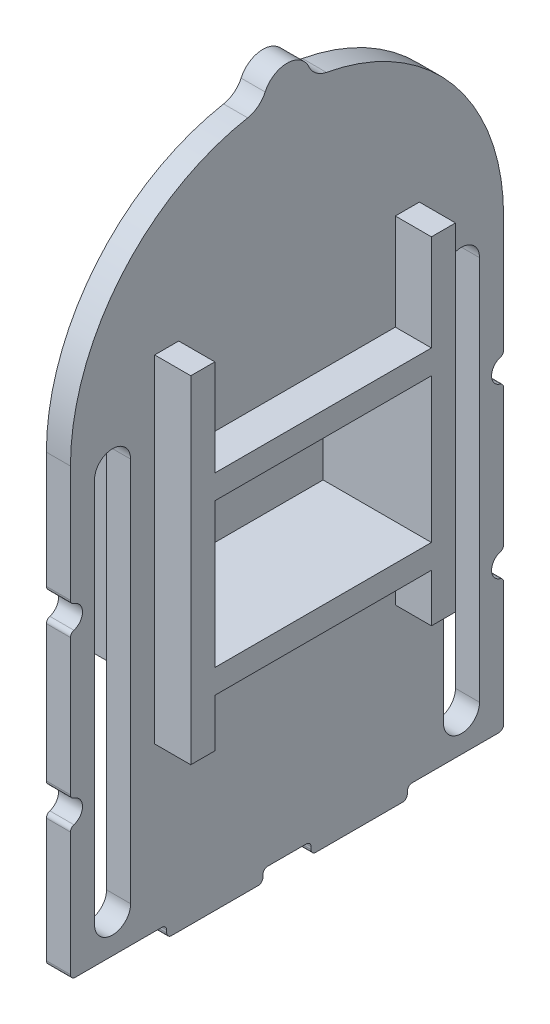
SolidWorks part; units mm, degrees
ref_plane "Face" through (0, 0, 0) normal (0, 0, 1) x (1, 0, 0)
ref_plane "Dessus" through (0, 0, 0) normal (0, 1, 0) x (1, 0, 0)
ref_plane "Droite" through (0, 0, 0) normal (1, 0, 0) x (0, 0, -1)
sketch "Esquisse1" plane through (0, 0, 0) normal (1, 0, 0) x (0, 0, -1)
  line L0 (9, 0) -> (9, -5)
  line L1 (-9, 0) -> (-9, -5)
  line L2 (9, -18.5) -> (5, -18.5)
  line L3 (-5, -19) -> (-1, -19)
  line L4 (5, -18.5) -> (5, -19)
  line L5 (1, -19) -> (1, -18.5)
  line L6 (1, -18.5) -> (-1, -18.5)
  line L7 (-1, -18.5) -> (-1, -19)
  line L8 (-5, -19) -> (-5, -18.5)
  line L9 (-5, -18.5) -> (-9, -18.5)
  line L10 (-13.0095, -12.5) -> (10.4273, -12.5) construction
  line L11 (10.4273, -5.5) -> (-12.6677, -5.5) construction
  line L12 (1, -19) -> (5, -19)
  line L13 (0, 0) -> (0, -17.0505) construction
  line L14 (9, -6) -> (9, -12)
  line L15 (6.5, -1) -> (6.5, -17)
  line L16 (9, -13) -> (9, -18.5)
  line L17 (-8, -1) -> (-8, -17)
  line L18 (-9, -6) -> (-9, -12)
  line L19 (8, -1) -> (8, -17)
  line L20 (-9, -13) -> (-9, -18.5)
  line L21 (-6.5, -1) -> (-6.5, -17)
  arc A0 (9, 0) -> (1.6363, 8.85) centre (0, 0) ccw
  arc A1 (9, -5) -> (9, -6) centre (9, -5.5) ccw
  arc A2 (9, -12) -> (9, -13) centre (9, -12.5) ccw
  arc A3 (-9, -6) -> (-9, -5) centre (-9, -5.5) ccw
  arc A4 (-9, -13) -> (-9, -12) centre (-9, -12.5) ccw
  arc A5 (-6.5, -1) -> (-8, -1) centre (-7.25, -1) ccw
  arc A6 (-8, -17) -> (-6.5, -17) centre (-7.25, -17) ccw
  arc A7 (8, -17) -> (6.5, -17) centre (7.25, -17) cw
  arc A8 (6.5, -1) -> (8, -1) centre (7.25, -1) cw
  arc A9 (0.9091, 9.4167) -> (-0.9091, 9.4167) centre (0, 9) ccw
  arc A10 (-0.9091, 9.4167) -> (-1.6363, 8.85) centre (-1.8181, 9.8333) cw
  arc A11 (-1.6363, 8.85) -> (-9, 0) centre (0, 0) ccw
  arc A12 (0.9091, 9.4167) -> (1.6363, 8.85) centre (1.8181, 9.8333) ccw
  point P46 (0, 0)
  point P48 (-0.5183, 8.9851)
  point P50 (-0.9985, 8.9444)
  dimension "D3" = 18.5
  dimension "D4" = 4
  dimension "D8" = 4
  dimension "D9" = 0.5
  dimension "D10" = 0.5
  dimension "D11" = 0.5
  dimension "D12" = 0.5
  dimension "D21" = 1
  dimension "D22" = 1
  dimension "D1" = 19
  dimension "D2" = 9
  dimension "D5" = 4
  dimension "D6" = 2
  dimension "D7" = 1
  dimension "D13" = 13
  dimension "D14" = 7
  dimension "D15" = 9
  dimension "D16" = 9
  dimension "D17" = 1.5
  dimension "D18" = 1
  dimension "D19" = 16
  dimension "D20" = 1
extrude "Extrusion1" add sketch "Esquisse1" along normal blind 1
sketch "Esquisse2" plane through (0, 0, 0) normal (-1, 0, 0) x (0, 0, 1)
  line L1 (-5.5, -9.75) -> (5.5, -9.75)
  line L2 (-5.5, -9.75) -> (-5.5, -1.75)
  line L3 (-5.5, -1.75) -> (5.5, -1.75)
  line L4 (5.5, -9.75) -> (5.5, -1.75)
  arc A0 (8, -1) -> (6.5, -1) centre (7.25, -1) ccw construction
  dimension "D1" = 8
  dimension "D3" = 11
  dimension "D4" = 5.5
extrude "Extrusion2" add sketch "Esquisse2" along normal blind 3
fillet "Congé1" radius 1 4 edges at (-3, -9.75, 0) (-3, -5.75, 5.5) (-3, -1.75, 0) (-3, -5.75, -5.5)
sketch "Esquisse3" plane through (0, 0, 0) normal (0, 0, 1) x (1, 0, 0)
  line L0 (-3, -2.75) -> (-3, -8.75) construction
  line L1 (-3, -5.25) -> (-3, -6.25)
  line L2 (-3, -3.05) -> (-3, -4.05)
  line L3 (-3, -7.45) -> (-3, -8.45)
  arc A0 (-3, -5.25) -> (-3, -6.25) centre (-3, -5.75) ccw
  arc A1 (-3, -3.05) -> (-3, -4.05) centre (-3, -3.55) ccw
  arc A2 (-3, -7.45) -> (-3, -8.45) centre (-3, -7.95) ccw
  dimension "D1" = 0.5
  dimension "D2" = 2.2
  dimension "D3" = 2.2
extrude "Extrusion4" add sketch "Esquisse3" along normal blind 4 and the other way blind 4
fillet "Congé2" radius 0.2 18 edges at (0.5, -18.5, 1) (0.5, -13, 9) (0.5, -6, 9) (0.5, -18.5, 5) (0.5, -18.5, -1) (0.5, -12, 9) (0.5, -5, 9) (0.5, -18.5, 9) (0.5, -18.5, -9) (0.5, -19, 5) (0.5, -19, 1) (0.5, -19, -1) (0.5, -19, -5) (0.5, -18.5, -5) (0.5, -13, -9) (0.5, -12, -9) (0.5, -6, -9) (0.5, -5, -9)
sketch "Esquisse4" plane through (1, 0, 0) normal (1, 0, 0) x (0, 0, -1)
  line L1 (-4.5, -2.75) -> (4.5, -2.75)
  line L2 (-4.5, -2.75) -> (-4.5, -8.75)
  line L3 (-4.5, -8.75) -> (4.5, -8.75)
  line L4 (4.5, -2.75) -> (4.5, -8.75)
  dimension "D1" = 9
  dimension "D2" = 4.5
  dimension "D3" = 6
  dimension "D4" = 2.75
extrude "Enlèv. mat.-Extru.1" cut sketch "Esquisse4" against normal blind 3
sketch "Esquisse5" plane through (1, 0, 0) normal (1, 0, 0) x (0, 0, -1)
  line L0 (-4.5, -1.75) -> (-4.5, 2.25)
  line L1 (-4.5, -2.75) -> (4.5, -2.75)
  line L2 (-4.5, -2.75) -> (-4.5, -8.75)
  line L3 (-4.5, -8.75) -> (4.5, -8.75)
  line L4 (4.5, -2.75) -> (4.5, -8.75)
  line L5 (-4.5, 2.25) -> (-5.5, 2.25)
  line L6 (-5.5, 2.25) -> (-5.5, -11.75)
  line L7 (-5.5, -11.75) -> (-4.5, -11.75)
  line L8 (-4.5, -11.75) -> (-4.5, -9.75)
  line L9 (-4.5, -9.75) -> (4.5, -9.75)
  line L10 (4.5, -9.75) -> (4.5, -11.75)
  line L11 (4.5, -11.75) -> (5.5, -11.75)
  line L12 (5.5, -11.75) -> (5.5, 2.25)
  line L13 (5.5, 2.25) -> (4.5, 2.25)
  line L14 (4.5, 2.25) -> (4.5, -1.75)
  line L15 (4.5, -1.75) -> (-4.5, -1.75)
  dimension "D1" = 5
  dimension "D2" = 14
  dimension "D3" = 1
  dimension "D4" = 1
  dimension "D5" = 1
  dimension "D6" = 1
extrude "Extrusion5" add sketch "Esquisse5" along normal blind 1.5
